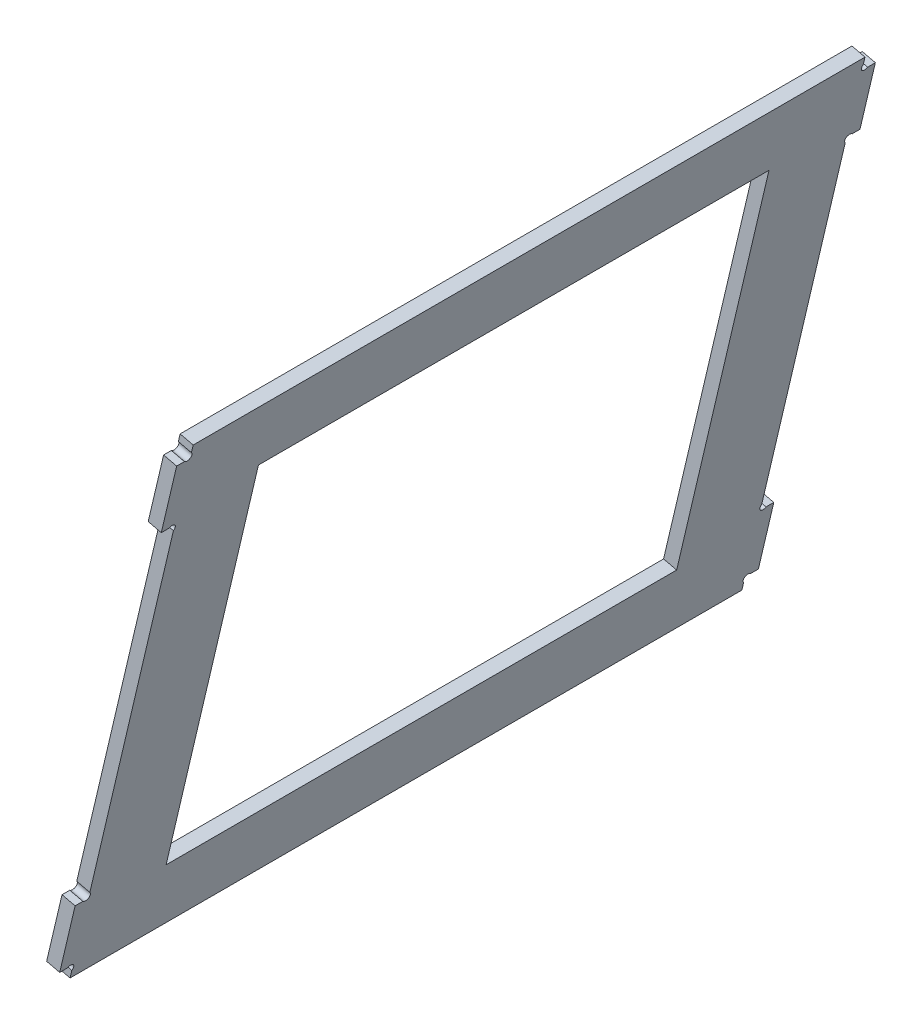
SolidWorks part; units mm, degrees
ref_plane "Alzado" through (0, 0, 0) normal (0, 0, 1) x (1, 0, 0)
ref_plane "Planta" through (0, 0, 0) normal (0, 1, 0) x (1, 0, 0)
ref_plane "Vista lateral" through (0, 0, 0) normal (1, 0, 0) x (0, 0, -1)
sketch "Croquis1" plane through (0, 0, 0) normal (0, 0, 1) x (1, 0, 0)
  line L0 (-238.2198, 152.7858) -> (-228.4857, 150.495)
  line L1 (-238.2198, 152.7858) -> (-146.5898, 542.1493)
  line L2 (-228.4857, 150.495) -> (-136.8557, 539.8585)
  line L3 (-146.5898, 542.1493) -> (-136.8557, 539.8585)
  arc A0 (-275.4495, 165.5551) -> (-216.7148, 567.1757) centre (-587.1465, 416.2441) ccw construction
  dimension "D1" = 10
  dimension "D2" = 400
extrude "Saliente-Extruir1" add sketch "Croquis1" against normal up to surface (500 mm away)
ref_plane "Plano1" through (0, 0, 250) normal (0, 0, 1) x (1, 0, 0)
sketch "Croquis3" plane through (-259.7879, 61.1366, 0) normal (-0.9734, 0.2291, 0) x (0, 0, 1)
  line L0 (0, 494.1528) -> (500, 94.1528) construction
  line L1 (500, 494.1528) -> (0, 94.1528) construction
  line L3 (440, 144.1528) -> (60, 144.1528)
  line L4 (440, 144.1528) -> (440, 444.1528)
  line L5 (440, 444.1528) -> (60, 444.1528)
  line L6 (60, 144.1528) -> (60, 444.1528)
  line L7 (440, 144.1528) -> (60, 444.1528) construction
  line L8 (440, 444.1528) -> (60, 144.1528) construction
  point P8 (250, 294.1528)
  dimension "D1" = 380
  dimension "D2" = 300
extrude "Cortar-Extruir1" cut sketch "Croquis3" against normal through all both and the other way through all
sketch "Croquis4" plane through (-259.7879, 61.1366, 0) normal (-0.9734, 0.2291, 0) x (0, 0, 1)
  line L0 (0, 104.1528) -> (0, 154.1528)
  line L1 (0, 104.1528) -> (-10, 104.1528)
  line L2 (0, 154.1528) -> (-10, 154.1528)
  line L3 (-10, 104.1528) -> (-10, 154.1528)
  line L4 (0, 494.1528) -> (0, 94.1528) construction
  line L5 (500, 94.1528) -> (0, 94.1528) construction
  dimension "D1" = 10
  dimension "D2" = 50
  dimension "D3" = 10
extrude "Saliente-Extruir2" add sketch "Croquis4" against normal blind 10
sketch "Croquis5" plane through (-259.7879, 61.1366, 0) normal (-0.9734, 0.2291, 0) x (0, 0, 1)
  line L0 (-2.1213, 104.1528) -> (-2.1213, 102.0315) construction
  line L1 (-10, 104.1528) -> (0, 104.1528) construction
  line L2 (-2.1213, 102.0315) -> (0, 102.0315) construction
  line L3 (0, 104.1528) -> (0, 94.1528) construction
  line L4 (-10, 129.1528) -> (24.8996, 129.1528) construction
  line L5 (-10, 154.1528) -> (-10, 104.1528) construction
  line L6 (-2.1213, 156.2741) -> (0, 156.2741) construction
  line L7 (-2.1213, 154.1528) -> (-2.1213, 156.2741) construction
  circle A0 centre (-2.1213, 102.0315) radius 3
  circle A1 centre (-2.1213, 156.2741) radius 3
  dimension "D1" = 6
ref_plane "Plano2" through (0, 0, 250) normal (0, 0, -1) x (-1, 0, 0)
extrude "Cortar-Extruir3" cut sketch "Croquis5" against normal through all both and the other way through all
ref_plane "Plano3" through (67.3831, 286.3309, 0) normal (-0.2291, -0.9734, 0) x (-0.9734, 0.2291, 0)
mirror "Simetría2" about plane through (67.3831, 286.3309, 0) normal (-0.2291, -0.9734, 0) of "Cortar-Extruir3", "Saliente-Extruir2"
mirror "Simetría3" about plane through (0, 0, 250) normal (0, 0, -1) of "Simetría2", "Saliente-Extruir2", "Cortar-Extruir3"
